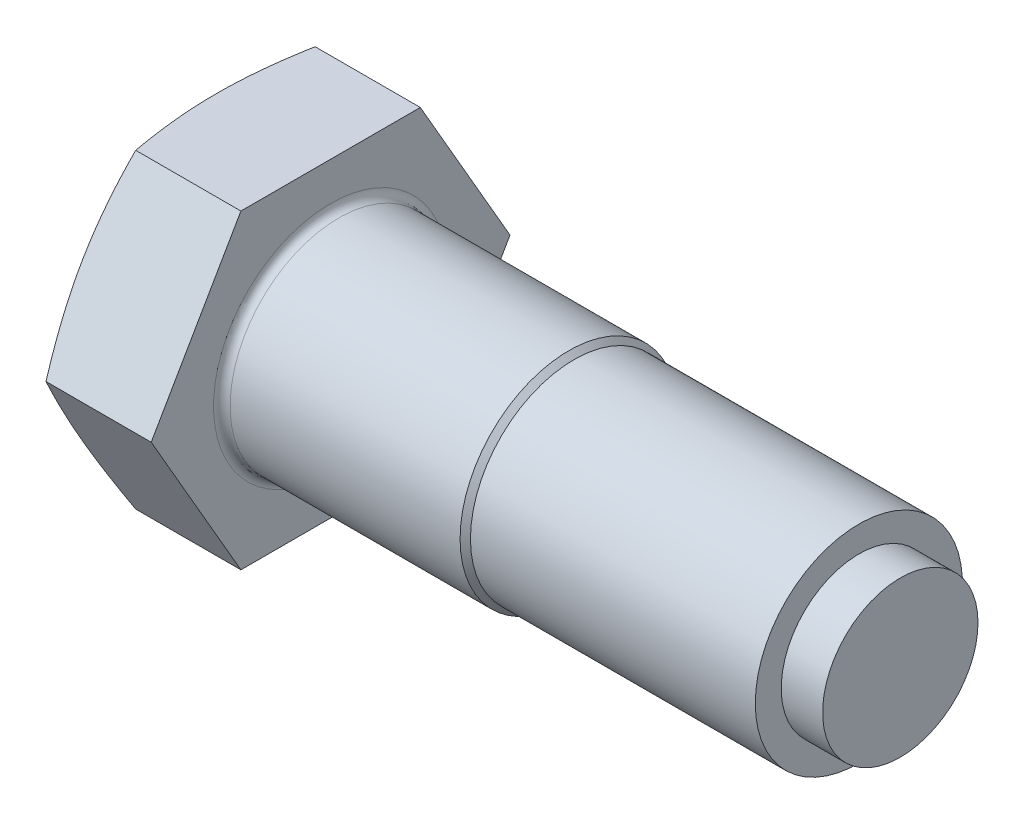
SolidWorks part; units mm, degrees
ref_plane "Front" through (0, 0, 0) normal (0, 0, 1) x (1, 0, 0)
ref_plane "Top" through (0, 0, 0) normal (0, 1, 0) x (1, 0, 0)
ref_plane "Right" through (0, 0, 0) normal (1, 0, 0) x (0, 0, -1)
sketch "Sketch1" plane through (0, 0, 0) normal (1, 0, 0) x (0, 0, -1)
  line L1 (17.3205, 0) -> (8.6603, 15)
  line L2 (8.6603, 15) -> (-8.6603, 15)
  line L3 (-8.6603, 15) -> (-17.3205, 0)
  line L4 (-17.3205, 0) -> (-8.6603, -15)
  line L5 (-8.6603, -15) -> (8.6603, -15)
  line L6 (8.6603, -15) -> (17.3205, 0)
  circle A0 centre (0, 0) radius 15 construction
  dimension "s" = 30
extrude "BaseHead" add sketch "Sketch1" along normal blind 11
sketch "Sketch2" plane through (11, 0, 0) normal (1, 0, 0) x (0, 0, -1)
  circle A0 centre (0, 0) radius 10.5
  dimension "ds" = 21
extrude "Basebody1" add sketch "Sketch2" along normal blind 23
sketch "Sketch4" plane through (34, 0, 0) normal (1, 0, 0) x (0, 0, -1)
  circle A0 centre (0, 0) radius 10
  dimension "d" = 20
extrude "Basebody2" add sketch "Sketch4" along normal offset from surface (32 mm away) 55
sketch "Sketch5" plane through (66, 0, 0) normal (1, 0, 0) x (0, 0, -1)
  circle A0 centre (0, 0) radius 7.5
  dimension "dp" = 15
extrude "Cut-Extrude1" cut sketch "Sketch5" against normal blind 4 flip side to cut
sketch "Sketch6" plane through (0, 0, 0) normal (0, 1, 0) x (1, 0, 0)
  line L0 (0, 17.3205) -> (0.8446, 17.3205)
  line L1 (0.8446, 17.3205) -> (0, 15)
  line L3 (0, 15) -> (0, 17.3205)
  line L4 (-1.5773, 0) -> (3.1205, 0) construction
  line L6 (11, 17.3205) -> (0, 17.3205) construction
  dimension "D1" = 20
  dimension "D2" = 30
revolve "HeadChamfer" cut sketch "Sketch6" angle 360 about L4
fillet "HeadFillet" radius 0.8 1 edges at (11, 0, -10.5)
chamfer "Chamfer1" distance 0.5 angle 45 1 edges at (34, 0, -10)
equation "\"D1@Chamfer1\" =  ( \"ds@Sketch2\" - \"d@Sketch4\" )  / 2"
equation "\"D2@Sketch6\" = \"s@Sketch1\""
